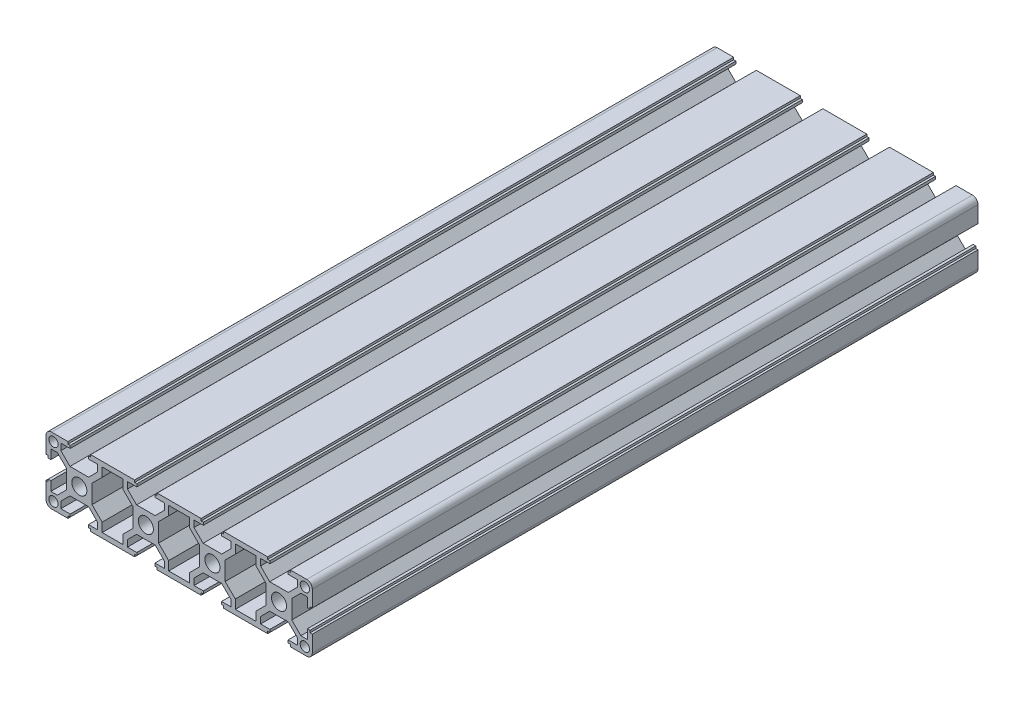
SolidWorks part; units mm, degrees
ref_plane "前视基准面" through (0, 0, 0) normal (0, 0, 1) x (1, 0, 0)
ref_plane "上视基准面" through (0, 0, 0) normal (0, 1, 0) x (1, 0, 0)
ref_plane "右视基准面" through (0, 0, 0) normal (1, 0, 0) x (0, 0, -1)
sketch "草图1"
sketch_block_instance "A$C1E0B47DA-1"
sketch_block "A$C1E0B47DA"
extrude "凸台-拉伸1" add sketch "草图1" along normal mid plane 300
